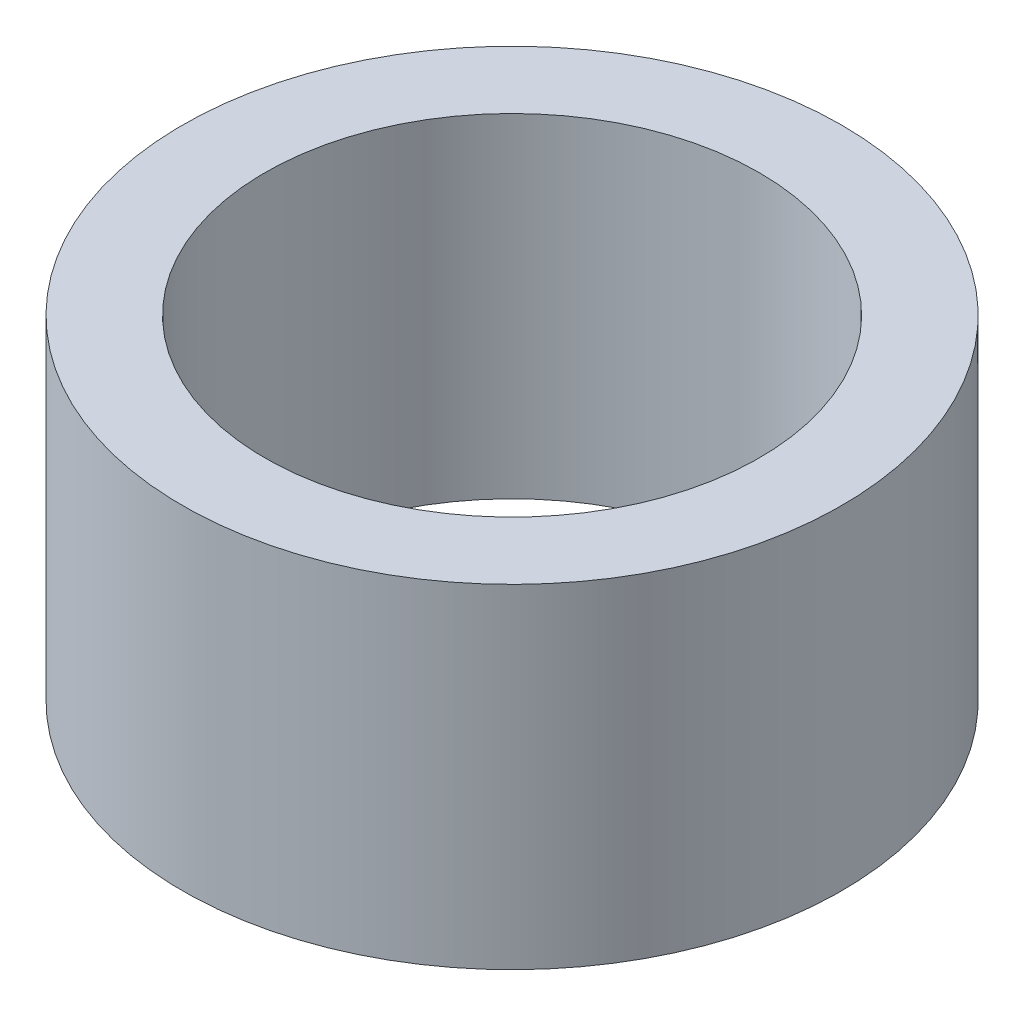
SolidWorks part; units mm, degrees
ref_plane "Plan de face" through (0, 0, 0) normal (0, 0, 1) x (1, 0, 0)
ref_plane "Plan de dessus" through (0, 0, 0) normal (0, 1, 0) x (1, 0, 0)
ref_plane "Plan de droite" through (0, 0, 0) normal (1, 0, 0) x (0, 0, -1)
sketch "Esquisse1" plane through (0, 0, 0) normal (0, 0, 1) x (1, 0, 0)
  line L0 (4, 4.05) -> (3, 4.05)
  line L1 (3, 4.05) -> (3, 0)
  line L2 (3, 0) -> (4, 0)
  line L3 (4, 0) -> (4, 4.05)
  line L4 (0, 4.05) -> (0, 0) construction
revolve "Révolution1" add sketch "Esquisse1" angle 360 about L4
